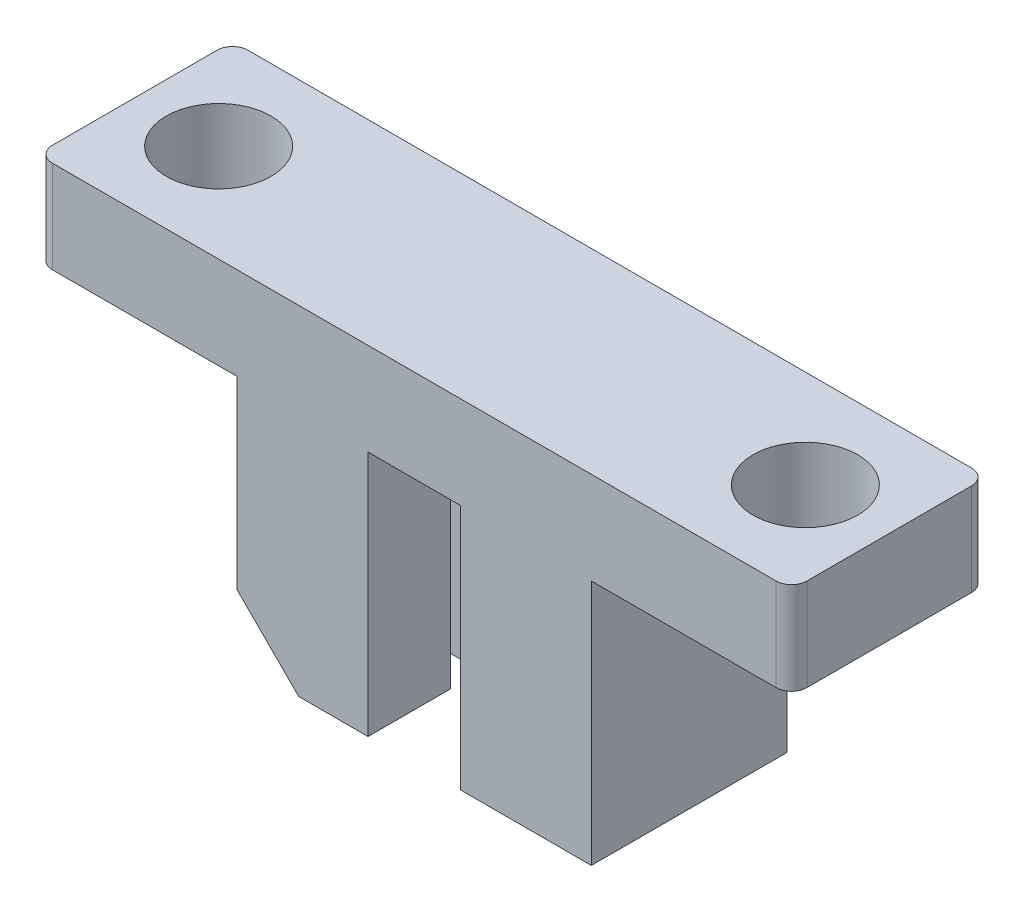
SolidWorks part; units mm, degrees
ref_plane "Plan de face" through (0, 0, 0) normal (0, 0, 1) x (1, 0, 0)
ref_plane "Plan de dessus" through (0, 0, 0) normal (0, 1, 0) x (1, 0, 0)
ref_plane "Plan de droite" through (0, 0, 0) normal (1, 0, 0) x (0, 0, -1)
sketch "Esquisse1" plane through (0, 0, 0) normal (0, 0, 1) x (1, 0, 0)
  line L0 (-12.25, 0) -> (12.25, 0)
  line L1 (12.25, 0) -> (12.25, -3)
  line L2 (12.25, -3) -> (5.75, -3)
  line L3 (5.75, -3) -> (5.75, -11)
  line L4 (5.75, -11) -> (1.5, -11)
  line L5 (1.5, -11) -> (1.5, -3)
  line L6 (1.5, -3) -> (-1.5, -3)
  line L7 (-1.5, -3) -> (-1.5, -11)
  line L8 (-1.5, -11) -> (-3.75, -11)
  line L9 (-5.75, -9) -> (-5.75, -3)
  line L10 (-5.75, -3) -> (-12.25, -3)
  line L11 (-12.25, -3) -> (-12.25, 0)
  line L12 (-3.75, -11) -> (-5.75, -9)
  point P11 (-5.75, -11)
extrude "Boss.-Extru.1" add sketch "Esquisse1" along normal mid plane 6.35
sketch "Esquisse2" plane through (0, -11, 0) normal (0, -1, 0) x (1, 0, 0)
  line L1 (2.675, -0.5) -> (-2.675, -0.5)
  line L2 (2.675, -0.5) -> (2.675, 0.5)
  line L3 (2.675, 0.5) -> (-2.675, 0.5)
  line L4 (-2.675, -0.5) -> (-2.675, 0.5)
  line L5 (2.675, -0.5) -> (-2.675, 0.5) construction
  line L6 (2.675, 0.5) -> (-2.675, -0.5) construction
  point P0 (0, 0)
extrude "Enlèv. mat.-Extru.1" cut sketch "Esquisse2" against normal blind 5.5
hole_wizard "Dégagement M31" positions "Esquisse4" profile "Esquisse3" hole size "M3" standard "Ansi Metric"
sketch "Esquisse4" plane through (0, -3, 0) normal (0, -1, 0) x (-1, 0, 0)
  point P0 (9.525, 0)
  point P2 (-9.525, 0)
sketch "Esquisse3" plane through (-9.525, -3, 0) normal (1, 0, 0) x (0, 0, -1)
  line L0 (0, 0) -> (0, 3)
  line L1 (0, 3) -> (1.7, 3)
  line L2 (1.7, 3) -> (1.7, 0)
  line L5 (1.7, 0) -> (0, 0)
  line L11 (0, -6.35) -> (0, 107.95) construction
  dimension "Diamètre du perçage jusqu'au prochain" = 3.4
  dimension "Profondeur du perçage jusqu'au prochain" = 3
fillet "Congé1" radius 0.5 4 edges at (-12.25, -1.5, 3.175) (12.25, -1.5, 3.175) (12.25, -1.5, -3.175) (-12.25, -1.5, -3.175)
equation "\"D5@Esquisse1\"=\"D4@Esquisse1\""
equation "\"D7@Esquisse1\"=\"D2@Esquisse1\""
equation "\"D2@Esquisse4\"=\"D1@Esquisse4\"/2"
